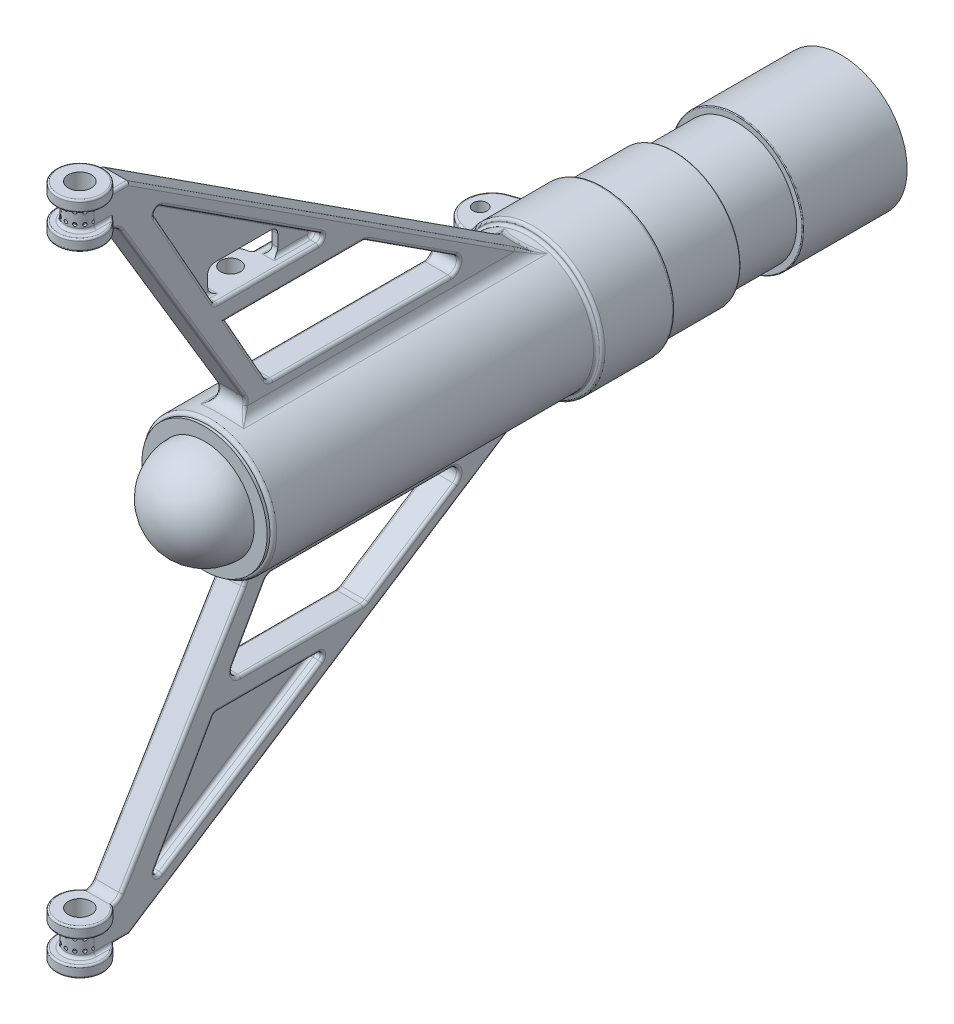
SolidWorks part; units mm, degrees
ref_plane "Plan de face" through (0, 0, 0) normal (0, 0, 1) x (1, 0, 0)
ref_plane "Plan de dessus" through (0, 0, 0) normal (0, 1, 0) x (1, 0, 0)
ref_plane "Plan de droite" through (0, 0, 0) normal (1, 0, 0) x (0, 0, -1)
imported_body "Importée1"
imported_body "Importée2"
sketch3d "Esquisse3D1"
  line L0 (0, 600, 1926.965) -> (0, 520, 1926.965) construction
  point P0 (0, 0, 1926.965)
sketch "Esquisse2" plane through (-5, 0, 0) normal (-1, 0, 0) x (0, 0, 1)
  line L1 (1742.9251, 360.0371) -> (1560.219, 360.0371)
  line L2 (1742.9251, 360.0371) -> (1756.9933, 385.0371)
  line L3 (1756.9933, 385.0371) -> (1598.7823, 385.0371)
  line L4 (1560.219, 360.0371) -> (1598.7823, 385.0371)
  line L5 (1803.5775, 517.8026) -> (1520.1837, 334.0829) construction
  line L6 (1718.5938, 316.7992) -> (1821.9785, 500.5189) construction
  line L8 (1448.6428, 280.0371) -> (1691.6688, 280.0371) construction
  dimension "D1" = 25
  dimension "D2" = 80
extrude "Boss.-Extru.2" add sketch "Esquisse2" along normal up to surface (20 mm away)
sketch "Esquisse1" plane through (0, 280.0371, 0) normal (0, -1, 0) x (1, 0, 0)
  line L0 (-20, 1448.6428) -> (-20, 1691.6688) construction
  line L1 (-20, 1448.6428) -> (20, 1448.6428) construction
  line L2 (-5, 1809.5612) -> (-5, 1619.0038) construction
  line L3 (-20, 1598.6428) -> (0, 1598.6428)
  line L5 (-20, 1678.6428) -> (0, 1678.6428)
  line L6 (0, 1598.6428) -> (0, 1678.6428)
  arc A0 (-20, 1678.6428) -> (-20, 1598.6428) centre (-20, 1638.6428) ccw
  dimension "D3" = 40
  dimension "D1" = 190
  dimension "D2" = 5
extrude "Boss.-Extru.1" add sketch "Esquisse1" against normal up to surface (105 mm away)
sketch "Esquisse3" plane through (-5, 0, 0) normal (-1, 0, 0) x (0, 0, 1)
  line L0 (1591.5877, 315.1746) -> (1692.2848, 315.1746)
  line L1 (1598.6428, 315.1746) -> (1527.2554, 315.1746) construction
  line L2 (1707.2644, 315.1746) -> (1678.6428, 315.1746) construction
  line L3 (1704.2846, 327.106) -> (1704.4039, 347.9685)
  line L4 (1678.6428, 360.0371) -> (1730.303, 360.0371) construction
  line L5 (1692.4041, 360.0371) -> (1591.5877, 360.0371)
  line L6 (1598.9565, 360.0371) -> (1560.219, 360.0371) construction
  line L7 (1579.5877, 348.0371) -> (1579.5877, 327.1746)
  arc A0 (1704.4039, 347.9685) -> (1692.4041, 360.0371) centre (1692.4041, 348.0371) ccw
  arc A1 (1692.2848, 315.1746) -> (1704.2846, 327.106) centre (1692.2848, 327.1746) ccw
  arc A2 (1591.5877, 315.1746) -> (1579.5877, 327.1746) centre (1591.5877, 327.1746) cw
  arc A3 (1591.5877, 360.0371) -> (1579.5877, 348.0371) centre (1591.5877, 348.0371) ccw
  point P14 (1704.4729, 360.0371)
  point P17 (1704.2164, 315.1746)
  point P20 (1579.5877, 315.1746)
  point P23 (1579.5877, 360.0371)
  dimension "D1" = 12
extrude "Enlèv. mat.-Extru.1" cut sketch "Esquisse3" against normal through all and the other way through all
fillet "Congé1" radius 5 7 edges at (-23.5355, 385.0371, 1752.9365) (-15.5, 385.0371, 1751.256) (-6.7574, 385.0371, 1749.2395) (-23.5355, 385.0371, 1605.2817) (-15.5, 385.0371, 1607.9739) (-6.7574, 385.0371, 1611.2045) (-5, 385.0371, 1681.6875)
fillet "Congé2" radius 5 21 edges at (-27.365, 385.3697, 1599.3267) (-59.9403, 385.0371, 1640.8282) (-16.4755, 306.6281, 1598.7983) (-23.9155, 313.2841, 1678.4507) (-23.9155, 281.9276, 1598.8349) (-16.4755, 288.5837, 1678.4872) (-23.5355, 360.0371, 1738.8682) (-15.5, 360.0371, 1737.1878) (-6.7574, 360.0371, 1735.1713) (-23.5355, 360.0371, 1566.7184) (-15.5, 360.0371, 1569.4105) (-5, 360.0371, 1586.0141) (-25, 385.4392, 1752.3697) (-25, 297.6059, 1678.329) (-25, 297.6059, 1598.9565) (-60, 280.0371, 1638.6428) (-5, 360.0371, 1711.3535) (-6.7574, 360.0371, 1572.6411) (-25, 373.5253, 1598.9565) (-25, 372.5371, 1678.329) (-25, 385.0371, 1714.0994)
sketch "Esquisse4" plane through (0, 280.0371, 0) normal (0, -1, 0) x (1, 0, 0)
  circle A0 centre (-20, 1638.6428) radius 17.5
  dimension "D1" = 35
extrude "Enlèv. mat.-Extru.2" cut sketch "Esquisse4" against normal blind 110
sketch "Esquisse5" plane through (0, 0, 400) normal (0, 0, -1) x (-1, 0, 0)
  line L1 (-268.5069, -255.7455) -> (196.1904, -255.7455)
  line L2 (-268.5069, -255.7455) -> (-268.5069, 170.8282)
  line L3 (-268.5069, 170.8282) -> (196.1904, 170.8282)
  line L4 (196.1904, -255.7455) -> (196.1904, 170.8282)
extrude "Enlèv. mat.-Extru.3" cut sketch "Esquisse5" against normal blind 172
sketch "Esquisse6" plane through (0, 0, 0) normal (1, 0, 0) x (0, 0, -1)
  line L0 (-1926.965, -520) -> (-1926.965, 520) construction
  line L1 (-1926.965, -558.5609) -> (-1926.965, -493.8783) construction
  line L2 (-1906.465, -520) -> (-1947.465, -520) construction
  line L3 (-1947.465, 520) -> (-1906.465, 520) construction
  point P8 (-1926.965, 0)
